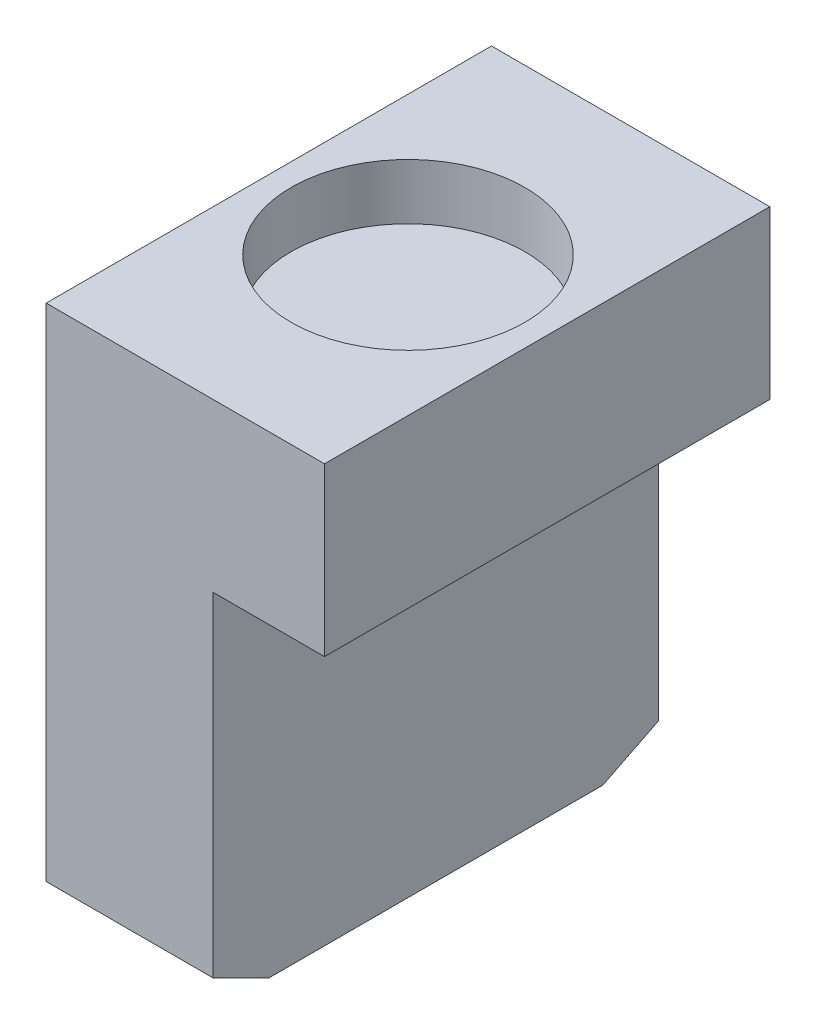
SolidWorks part; units mm, degrees
ref_plane "前视基准面" through (0, 0, 0) normal (0, 0, 1) x (1, 0, 0)
ref_plane "上视基准面" through (0, 0, 0) normal (0, 1, 0) x (1, 0, 0)
ref_plane "右视基准面" through (0, 0, 0) normal (1, 0, 0) x (0, 0, -1)
sketch "草图1" plane through (0, 0, 0) normal (0, 0, 1) x (1, 0, 0)
  line L0 (0, 0) -> (0, 9.5)
  line L1 (3, 0) -> (3, 6.5)
  line L2 (0, 0) -> (3, 0)
  line L3 (3, 6.5) -> (5, 6.5)
  line L4 (0, 9.5) -> (5, 9.5)
  line L5 (5, 6.5) -> (5, 9.5)
extrude "凸台-拉伸1" add sketch "草图1" along normal blind 8
sketch "草图2" plane through (0, 9.5, 0) normal (0, 1, 0) x (1, 0, 0)
  circle A0 centre (2.5, -4) radius 2.1
extrude "切除-拉伸1" cut sketch "草图2" against normal blind 1
sketch "草图4" plane through (3, 0, 0) normal (1, 0, 0) x (0, 0, -1)
  line L0 (-8, 0.5) -> (-8, 9.5)
  line L1 (0, 0.5) -> (0, 9.5)
  line L2 (-7, 0) -> (-1, 0)
  line L3 (-8, 9.5) -> (0, 9.5)
  line L4 (-7, 0) -> (-8, 0.5)
  line L5 (-1, 0) -> (0, 0.5)
extrude "切除-拉伸2" cut sketch "草图4" against normal blind 3 flip side to cut
